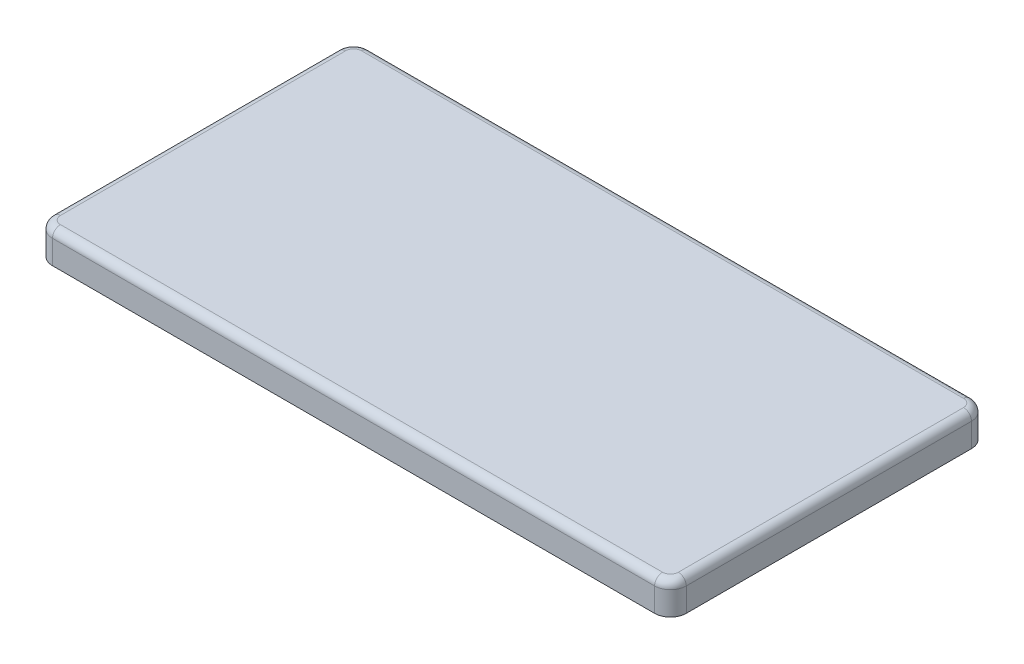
SolidWorks part; units mm, degrees
ref_plane "正面" through (0, 0, 0) normal (0, 0, 1) x (1, 0, 0)
ref_plane "平面" through (0, 0, 0) normal (0, 1, 0) x (1, 0, 0)
ref_plane "右側面" through (0, 0, 0) normal (1, 0, 0) x (0, 0, -1)
sketch "ｽｹｯﾁ1" plane through (0, 0, 0) normal (0, 1, 0) x (0, 0, -1)
  line L1 (-18, 40) -> (18, 40)
  line L2 (-20, 38) -> (-20, -38)
  line L3 (-18, -40) -> (18, -40)
  line L4 (20, 38) -> (20, -38)
  arc A0 (20, 38) -> (18, 40) centre (18, 38) ccw
  arc A1 (18, -40) -> (20, -38) centre (18, -38) ccw
  arc A2 (-20, -38) -> (-18, -40) centre (-18, -38) ccw
  arc A3 (-18, 40) -> (-20, 38) centre (-18, 38) ccw
  point P7 (20, 40)
  point P10 (20, -40)
  point P15 (-20, 40)
  dimension "D5" = 2
  dimension "D1" = 20
  dimension "D2" = 40
  dimension "D3" = 40
  dimension "D4" = 80
extrude "押し出し1" add sketch "ｽｹｯﾁ1" along normal mid plane 4
fillet "ﾌｨﾚｯﾄ1" radius 1 8 edges at (-39.4142, 2, 19.4142) (-40, 2, 0) (-39.4142, 2, -19.4142) (0, 2, -20) (39.4142, 2, -19.4142) (40, 2, 0) (39.4142, 2, 19.4142) (0, 2, 20)
sketch "ｽｹｯﾁ2" plane through (0, -2, 0) normal (0, -1, 0) x (1, 0, 0)
  line L1 (-37.2, 18) -> (37.2, 18)
  line L2 (-38, 17.2) -> (-38, -17.2)
  line L3 (-37.2, -18) -> (37.2, -18)
  line L4 (38, 17.2) -> (38, -17.2)
  arc A0 (-37.2, 18) -> (-38, 17.2) centre (-37.2, 17.2) ccw
  arc A1 (38, 17.2) -> (37.2, 18) centre (37.2, 17.2) ccw
  arc A2 (37.2, -18) -> (38, -17.2) centre (37.2, -17.2) ccw
  arc A3 (-38, -17.2) -> (-37.2, -18) centre (-37.2, -17.2) ccw
  point P7 (-38, 18)
  point P10 (38, 18)
  point P13 (38, -18)
  dimension "D5" = 0.8
  dimension "D1" = 38
  dimension "D2" = 76
  dimension "D3" = 18
  dimension "D4" = 36
extrude "押し出し2" cut sketch "ｽｹｯﾁ2" against normal blind 2
sketch "ｽｹｯﾁ4" plane through (0, 0, 0) normal (0, -1, 0) x (1, 0, 0)
  line L0 (-40, -18) -> (-40, 18) construction
  line L1 (-22.15, 3.15) -> (-17.85, 3.15)
  line L2 (-22.15, 3.15) -> (-22.15, -3.15)
  line L3 (-22.15, -3.15) -> (-17.85, -3.15)
  line L4 (-17.85, 3.15) -> (-17.85, -3.15)
  line L5 (40, 18) -> (40, -18) construction
  line L6 (17.85, 3.15) -> (22.15, 3.15)
  line L7 (17.85, 3.15) -> (17.85, -3.15)
  line L8 (17.85, -3.15) -> (22.15, -3.15)
  line L9 (22.15, 3.15) -> (22.15, -3.15)
  dimension "D1" = 4.3
  dimension "D2" = 6.3
  dimension "D3" = 17.85
  dimension "D4" = 3.15
  dimension "D5" = 4.3
  dimension "D6" = 17.85
extrude "押し出し4" add sketch "ｽｹｯﾁ4" along normal blind 11 draft 0.5
fillet "ﾌｨﾚｯﾄ2" radius 0.8 8 edges at (-20, -11, 3.054) (-17.946, -11, 0) (-20, -11, -3.054) (-22.054, -11, 0) (20, -11, 3.054) (22.054, -11, 0) (20, -11, -3.054) (17.946, -11, 0)
